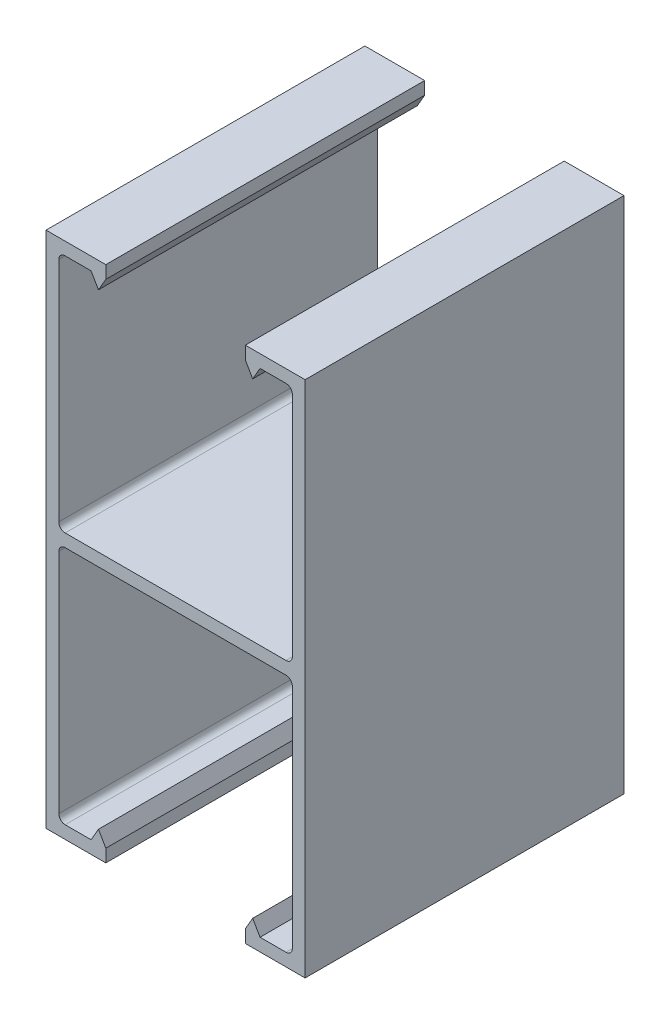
SolidWorks part; units mm, degrees
ref_plane "Plane1" through (0, 0, 0) normal (0, 0, 1) x (1, 0, 0)
ref_plane "Plane2" through (0, 0, 0) normal (0, 1, 0) x (1, 0, 0)
ref_plane "Plane3" through (0, 0, 0) normal (1, 0, 0) x (0, 0, -1)
sketch "Sketch1" plane through (0, 0, 0) normal (0, 0, 1) x (1, 0, 0)
  line L0 (-5.5563, 20.6375) -> (-10.3188, 20.6375)
  line L1 (-10.3188, 20.6375) -> (-10.3187, -20.6375)
  line L2 (-6.7294, -19.6215) -> (-8.7947, -19.6215)
  line L3 (10.3188, -20.6375) -> (10.3187, 20.6375)
  line L4 (10.3187, 20.6375) -> (5.5562, 20.6375)
  line L5 (8.7948, 19.6215) -> (6.7294, 19.6215)
  line L6 (9.3028, 1.016) -> (9.3028, 19.1135)
  line L7 (-8.7947, 0.508) -> (8.7948, 0.508)
  line L8 (-9.3028, 19.1135) -> (-9.3027, 1.016)
  line L9 (-6.7294, 19.6215) -> (-8.7948, 19.6215)
  line L10 (6.7294, 19.6215) -> (6.1428, 18.6055)
  line L11 (6.1428, 18.6055) -> (5.5562, 19.6215)
  line L12 (5.5562, 19.6215) -> (5.5562, 20.6375)
  line L13 (-6.7294, 19.6215) -> (-6.1428, 18.6055)
  line L14 (-6.1428, 18.6055) -> (-5.5563, 19.6215)
  line L15 (-5.5563, 19.6215) -> (-5.5563, 20.6375)
  line L16 (22.86, 0) -> (-25.4, 0) construction
  line L17 (6.1428, -18.6055) -> (5.5562, -19.6215)
  line L18 (6.7294, -19.6215) -> (6.1428, -18.6055)
  line L19 (8.7948, -19.6215) -> (6.7294, -19.6215)
  line L20 (10.3188, -20.6375) -> (5.5562, -20.6375)
  line L21 (5.5562, -19.6215) -> (5.5562, -20.6375)
  line L22 (-5.5562, -20.6375) -> (-10.3187, -20.6375)
  line L23 (-5.5562, -19.6215) -> (-5.5562, -20.6375)
  line L24 (-6.1428, -18.6055) -> (-5.5562, -19.6215)
  line L25 (-6.7294, -19.6215) -> (-6.1428, -18.6055)
  line L26 (-9.3027, -19.1135) -> (-9.3027, -1.016)
  line L27 (9.3028, -1.016) -> (9.3028, -19.1135)
  line L28 (-8.7947, -0.508) -> (8.7948, -0.508)
  arc A0 (-9.3027, 1.016) -> (-8.7947, 0.508) centre (-8.7947, 1.016) ccw
  arc A1 (-8.7948, 19.6215) -> (-9.3028, 19.1135) centre (-8.7948, 19.1135) ccw
  arc A2 (9.3028, 19.1135) -> (8.7948, 19.6215) centre (8.7948, 19.1135) ccw
  arc A3 (8.7948, 0.508) -> (9.3028, 1.016) centre (8.7948, 1.016) ccw
  arc A4 (9.3028, -19.1135) -> (8.7948, -19.6215) centre (8.7948, -19.1135) cw
  arc A5 (-8.7947, -19.6215) -> (-9.3027, -19.1135) centre (-8.7947, -19.1135) cw
  arc A6 (8.7948, -0.508) -> (9.3028, -1.016) centre (8.7948, -1.016) cw
  arc A7 (-9.3027, -1.016) -> (-8.7947, -0.508) centre (-8.7947, -1.016) cw
  dimension "D5" = 0.508
  dimension "D3" = 20.6375
  dimension "D4" = 60
  dimension "Width" = 20.6375
  dimension "Height" = 41.275
  dimension "D8" = 10.3187
  dimension "D10" = 11.1125
  dimension "edge" = 4.7625
  dimension "D13" = 0.5866
extrude "Base-Extrude" add sketch "Sketch1" along normal mid plane 25.4
equation "\"D8@Sketch1\" = \"Width@Sketch1\" / 2"
equation "\"D10@Sketch1\" = \"Width@Sketch1\" - 2 * \"edge@Sketch1\""
equation "\"D5@Sketch1\" = \"gauge@Sketch1\" / 2"
equation "\"D3@Sketch1\" = \"Height@Sketch1\" / 2"
equation "\"D13@Sketch1\" = \"gauge@Sketch1\" * .577350269"
